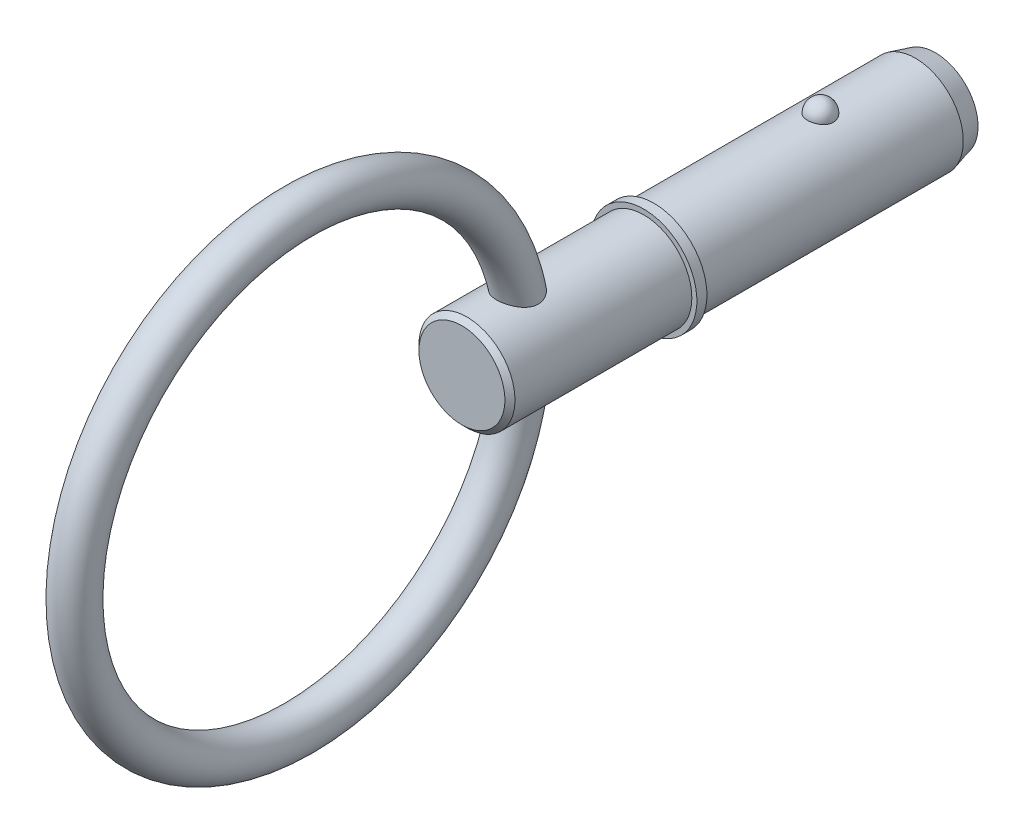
SolidWorks part; units mm, degrees
ref_plane "Front Plane" through (0, 0, 0) normal (0, 0, 1) x (1, 0, 0)
ref_plane "Top Plane" through (0, 0, 0) normal (0, 1, 0) x (1, 0, 0)
ref_plane "Right Plane" through (0, 0, 0) normal (1, 0, 0) x (0, 0, -1)
sketch "Sketch2" plane through (0, 0, 0) normal (0, 0, 1) x (1, 0, 0)
  circle A0 centre (0, 0) radius 4.765
  point P3 (0, 4.765)
  dimension "D1" = 9.53
extrude "Boss-Extrude1" add sketch "Sketch2" along normal blind 15.24
sketch "Sketch3" plane through (0, 0, 0) normal (0, 0, -1) x (-1, 0, 0)
  circle A0 centre (0, 0) radius 4.765
  dimension "D1" = 9.53
extrude "Boss-Extrude2" add sketch "Sketch3" along normal blind 12.7
chamfer "Chamfer1" distance 2 angle 15 1 edges at (-4.765, 0, -12.7)
sketch "Sketch18" plane through (0, 0, 0) normal (1, 0, 0) x (0, 0, -1)
  line L0 (10.7, 4.765) -> (-15.24, 4.765) construction
  line L1 (1.29, 6.055) -> (1.29, 3.475)
  line L2 (-15.24, -4.765) -> (10.7, -4.765) construction
  arc A0 (1.29, 6.055) -> (1.29, 3.475) centre (1.29, 4.765) ccw
  point P4 (0, 4.765)
  dimension "D1" = 10.82
revolve "Revolve1" add sketch "Sketch18" angle 360 about L1
sketch "Sketch19" plane through (0, 0, 0) normal (1, 0, 0) x (0, 0, -1)
  line L0 (-33.7288, 0) -> (-46.4542, 0) construction
sketch "Sketch20" plane through (0, 0, 0) normal (1, 0, 0) x (0, 0, -1)
  line L0 (-15.24, 0) -> (-15.24, 5.265)
  line L1 (-15.24, 4.765) -> (-15.24, -4.765) construction
  line L2 (-15.24, 5.265) -> (-16.24, 5.265)
  line L3 (-16.24, 5.265) -> (-16.24, 0)
  line L4 (-33.7288, 0) -> (-46.4542, 0) construction
  line L5 (-16.24, 0) -> (-15.24, 0)
  dimension "D1" = 5.265
  dimension "D2" = 1
revolve "Revolve2" add sketch "Sketch20" angle 360 about L0
sketch "Sketch21" plane through (0, 0, 15.24) normal (0, 0, -1) x (-1, 0, 0)
  circle A0 centre (0, 0) radius 4.765
  dimension "D1" = 9.53
extrude "Boss-Extrude3" add sketch "Sketch21" against normal blind 19.05
chamfer "Chamfer2" distance 0.5 angle 45 1 edges at (-4.765, 0, 34.29)
sketch "Sketch23" plane through (0, 0, 0) normal (1, 0, 0) x (0, 0, -1)
  line L0 (-34.29, 4.265) -> (-34.29, -4.265) construction
  circle A0 centre (-50.515, 0) radius 22.225
  point P2 (-28.29, 0)
  dimension "D1" = 44.45
  dimension "D2" = 6
sketch "Sketch24" plane through (0, 0, 0) normal (0, 1, 0) x (1, 0, 0)
  circle A0 centre (0, -28.29) radius 2
  dimension "D1" = 4
sweep "Sweep1" add profiles "Sketch24" path "Sketch23"
